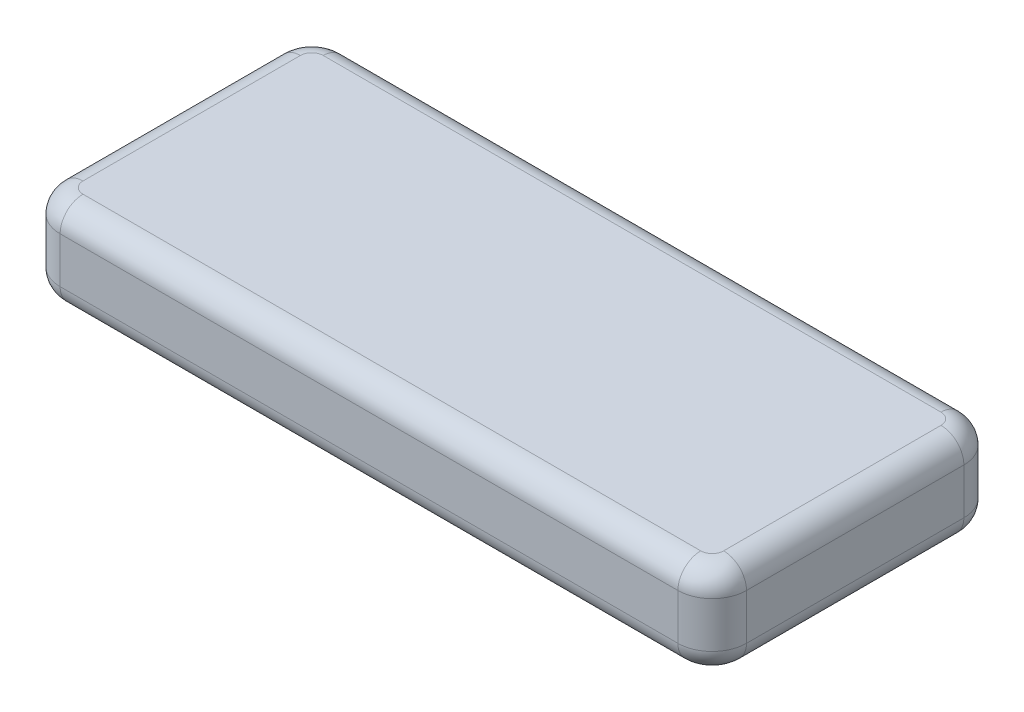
SolidWorks part; units mm, degrees
ref_plane "前视基准面" through (0, 0, 0) normal (0, 0, 1) x (1, 0, 0)
ref_plane "上视基准面" through (0, 0, 0) normal (0, 1, 0) x (1, 0, 0)
ref_plane "右视基准面" through (0, 0, 0) normal (1, 0, 0) x (0, 0, -1)
other "Configuration Table"
sketch "草图1" plane through (0, 0, 0) normal (0, 1, 0) x (1, 0, 0)
  line L1 (-27, -12.5) -> (27, -12.5)
  line L2 (-30, -9.5) -> (-30, 9.5)
  line L3 (-27, 12.5) -> (27, 12.5)
  line L4 (30, -9.5) -> (30, 9.5)
  line L5 (-30, -12.5) -> (30, 12.5) construction
  line L6 (-30, 12.5) -> (30, -12.5) construction
  arc A0 (27, -12.5) -> (30, -9.5) centre (27, -9.5) ccw
  arc A1 (-27, -12.5) -> (-30, -9.5) centre (-27, -9.5) cw
  arc A2 (30, 9.5) -> (27, 12.5) centre (27, 9.5) ccw
  arc A3 (-27, 12.5) -> (-30, 9.5) centre (-27, 9.5) ccw
  point P0 (0, 0)
  dimension "D3" = 3
  dimension "D1" = 60
  dimension "D2" = 25
extrude "凸台-拉伸1" add sketch "草图1" along normal mid plane 8
fillet "圆角1" radius 2 16 edges at (-29.1213, 4, 11.6213) (-30, 4, 0) (-29.1213, 4, -11.6213) (0, 4, -12.5) (29.1213, 4, -11.6213) (30, 4, 0) (29.1213, 4, 11.6213) (30, -4, 0) (29.1213, -4, -11.6213) (0, -4, -12.5) (-29.1213, -4, -11.6213) (-30, -4, 0) (-29.1213, -4, 11.6213) (0, -4, 12.5) (29.1213, -4, 11.6213) (0, 4, 12.5)
